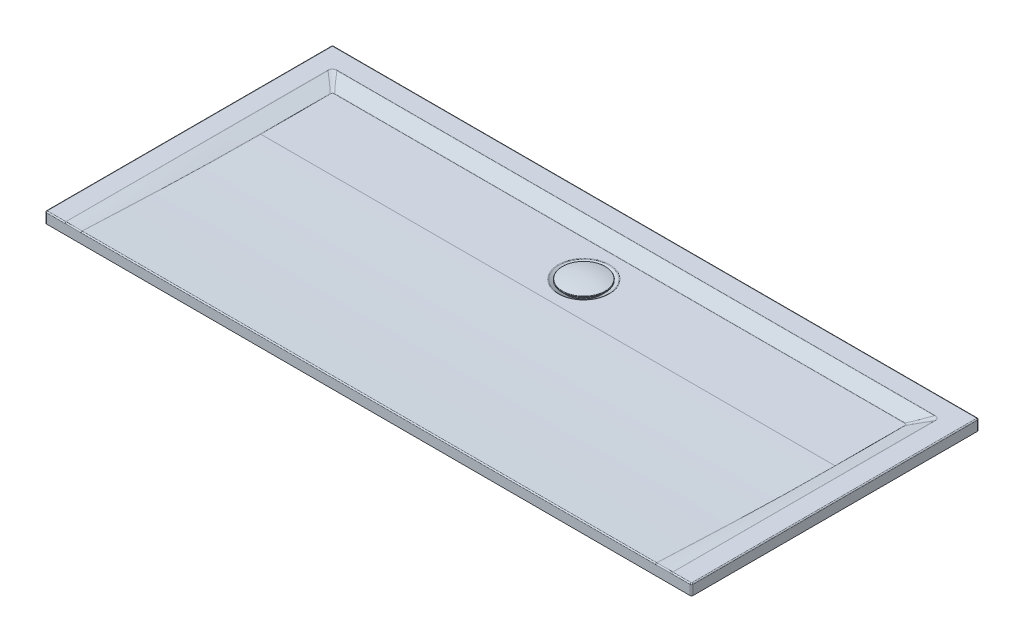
SolidWorks part; units mm, degrees
ref_plane "Płaszczyzna przednia" through (0, 0, 0) normal (0, 0, 1) x (1, 0, 0)
ref_plane "Płaszczyzna górna" through (0, 0, 0) normal (0, 1, 0) x (1, 0, 0)
ref_plane "Płaszczyzna prawa" through (0, 0, 0) normal (1, 0, 0) x (0, 0, -1)
sketch "Szkic1" plane through (0, 0, 0) normal (0, 1, 0) x (1, 0, 0)
  line L0 (0, 400) -> (0, -400) construction
  line L1 (-900, 400) -> (900, 400)
  line L2 (-900, 400) -> (-900, -400)
  line L3 (-900, -400) -> (900, -400)
  line L4 (900, 400) -> (900, -400)
  line L5 (-845, -400) -> (-845, 345)
  line L6 (-845, 345) -> (845, 345)
  line L7 (845, 345) -> (845, -400)
  line L8 (-800, -400) -> (-800, 300)
  line L9 (-800, 300) -> (800, 300)
  line L10 (800, 300) -> (800, -400)
  circle A0 centre (0, 200) radius 45
  circle A1 centre (0, 200) radius 70
  point P9 (0, 345)
  dimension "D6" = 90
  dimension "D7" = 140
  dimension "D1" = 1800
  dimension "D2" = 55
  dimension "D3" = 55
  dimension "D5" = 200
  dimension "D8" = 800
  dimension "D4" = 45
sketch "Szkic2" plane through (0, 0, 0) normal (0, 1, 0) x (1, 0, 0)
  line L0 (-900, -400) -> (900, -400) construction
  line L1 (900, 400) -> (900, -400) construction
  line L2 (845, 345) -> (845, -400) construction
  line L3 (-845, 345) -> (845, 345) construction
  line L4 (-900, 400) -> (900, 400) construction
  line L5 (-845, -400) -> (-845, 345) construction
  line L6 (-900, 400) -> (-900, -400) construction
  line L7 (-900, -400) -> (-845, -400)
  line L8 (900, 400) -> (900, -400)
  line L9 (845, 345) -> (845, -400)
  line L10 (-845, 345) -> (845, 345)
  line L11 (-900, 400) -> (900, 400)
  line L12 (-845, -400) -> (-845, 345)
  line L13 (-900, 400) -> (-900, -400)
  line L14 (845, -400) -> (900, -400)
surface "Powierzchnia-Płaszczyzna1" sketch "Szkic2"
ref_plane "Płaszczyzna1" through (0, -15, 0) normal (0, 1, 0) x (-1, 0, 0)
sketch "Szkic3" plane through (0, -15, 0) normal (0, 1, 0) x (-1, 0, 0)
  line L0 (800, -100) -> (-800, -100)
  line L1 (800, 400) -> (800, -300) construction
  line L2 (-800, -300) -> (-800, 400) construction
  line L3 (0, -100) -> (0, -300) construction
  line L4 (800, -300) -> (-800, -300) construction
  line L5 (-800, -300) -> (-800, -100)
  line L6 (800, -100) -> (800, -300)
  line L7 (800, -300) -> (-800, -300)
  circle A0 centre (0, -200) radius 70 construction
  circle A1 centre (0, -200) radius 70
  point P10 (0, -200)
surface "Powierzchnia-Płaszczyzna2" sketch "Szkic3"
sketch "Szkic4" plane through (0, 0, 0) normal (0, 1, 0) x (1, 0, 0)
  line L0 (800, -400) -> (-800, -400)
other "Granica-Powierzchnia1"
other "Granica-Powierzchnia2"
other "Granica-Powierzchnia3"
mirror "Lustro1" about plane through (0, 0, 0) normal (1, 0, 0)
sketch "Szkic5" plane through (0, 0, 0) normal (0, 1, 0) x (1, 0, 0)
  line L0 (900, 400) -> (900, -400) construction
  line L1 (-900, 400) -> (900, 400) construction
  line L2 (-900, 400) -> (-900, -400) construction
  line L3 (-900, -400) -> (900, -400) construction
  line L4 (900, 400) -> (900, -400)
  line L5 (-900, 400) -> (900, 400)
  line L6 (-900, 400) -> (-900, -400)
  line L7 (-900, -400) -> (900, -400)
surface "Powierzchnia-Wyciągnięcie1" sketch "Szkic5" parameters "D1"=30
sketch "Szkic7" plane through (0, 0, 0) normal (1, 0, 0) x (0, 0, -1)
  line L0 (200, 0) -> (200, -30) construction
  line L1 (400, -30) -> (-400, -30) construction
  line L2 (245, -30) -> (245, -28)
  line L3 (245, -28) -> (249, -28)
  line L6 (249, -28) -> (270, -15)
  dimension "D1" = 90
  dimension "D2" = 2
  dimension "D3" = 98
surface "Powierzchnia-Obrót wokół linii środkowej1" sketch "Szkic7" parameters "D1"=360
surface "Powierzchnia-Płaszczyzna3"
surface "Powierzchnia-Połącz1"
fillet "Zaokrąglenie1" radius 4 6 edges at (0, -28, -249) (0, -15, -130) (900, -15, 400) (900, -15, -400) (-900, -15, -400) (-900, -15, 400)
fillet "Zmienne zaokrąglenie1" radius 40 2 edges at (822.5, -7.5, -322.5)
fillet "Zaokrąglenie3" radius 3 12 edges
fillet "Zaokrąglenie4" radius 3 12 edges at (-898.8284, 0, -398.8284) (0, 0, -400) (898.8284, 0, -398.8284) (900, 0, 0) (898.8284, 0, 398.8284) (870.5, 0, 400) (-870.5, 0, 400) (-898.8284, 0, 398.8284) (-900, 0, 0)
sketch "Szkic8" plane through (0, 0, 0) normal (1, 0, 0) x (0, 0, -1)
  line L0 (200, 0) -> (200, -30) construction
  line L1 (200, -5.6601) -> (179.8469, -5.6601) construction
  line L2 (260, -14.7573) -> (260, -17)
  line L3 (260, -17) -> (200, -17)
  line L4 (200, -17) -> (200, -5.6601)
  line L5 (200, -5.6601) -> (199.9922, 95.6514)
  arc A0 (200, -5.6601) -> (259.2694, -13.7943) centre (200, -225.6601) cw
  arc A1 (259.2694, -13.7943) -> (260, -14.7573) centre (259, -14.7573) cw
  point P11 (260, -14)
  dimension "D1" = 220
  dimension "D4" = 1
  dimension "D2" = 60
  dimension "D3" = 3
  dimension "D5" = 13
revolve "Obrót wokół linii środkowej1" add sketch "Szkic8" angle 360 about L4
